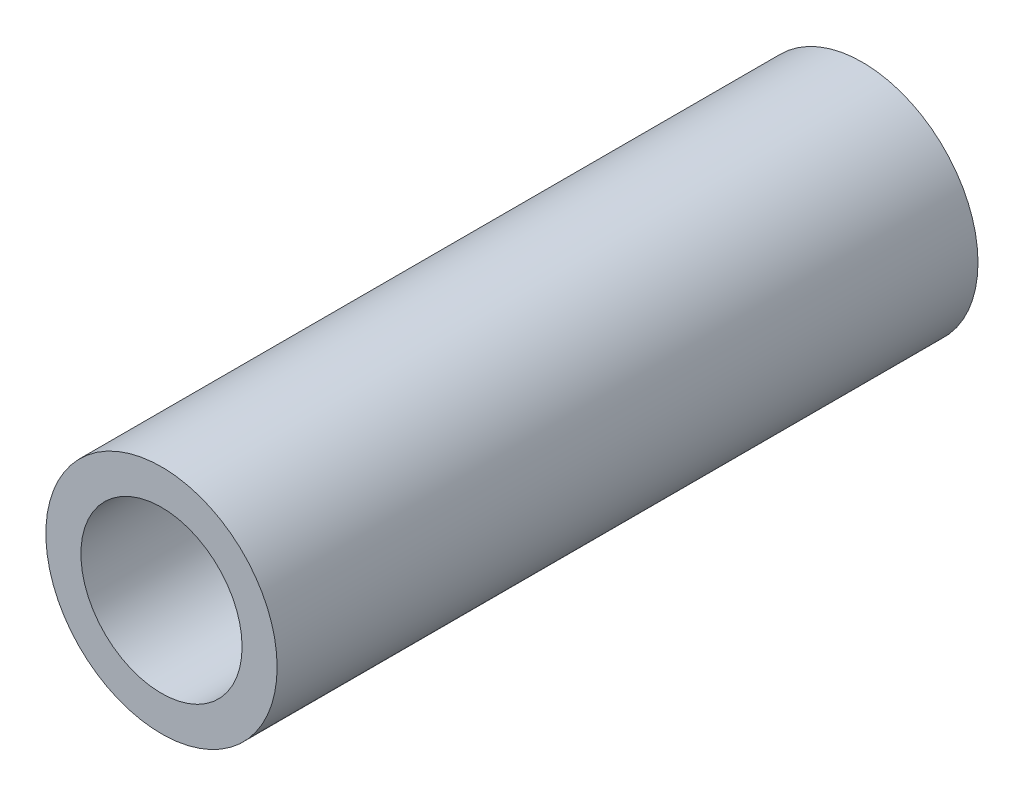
SolidWorks part; units mm, degrees
ref_plane "前视基准面" through (0, 0, 0) normal (0, 0, 1) x (1, 0, 0)
ref_plane "上视基准面" through (0, 0, 0) normal (0, 1, 0) x (1, 0, 0)
ref_plane "右视基准面" through (0, 0, 0) normal (1, 0, 0) x (0, 0, -1)
sketch "草图1" plane through (0, 0, 0) normal (0, 0, 1) x (1, 0, 0)
  circle A0 centre (0, 0) radius 23
  circle A1 centre (0, 0) radius 33
  dimension "D1" = 46
  dimension "D2" = 66
extrude "拉伸1" add sketch "草图1" along normal blind 200
